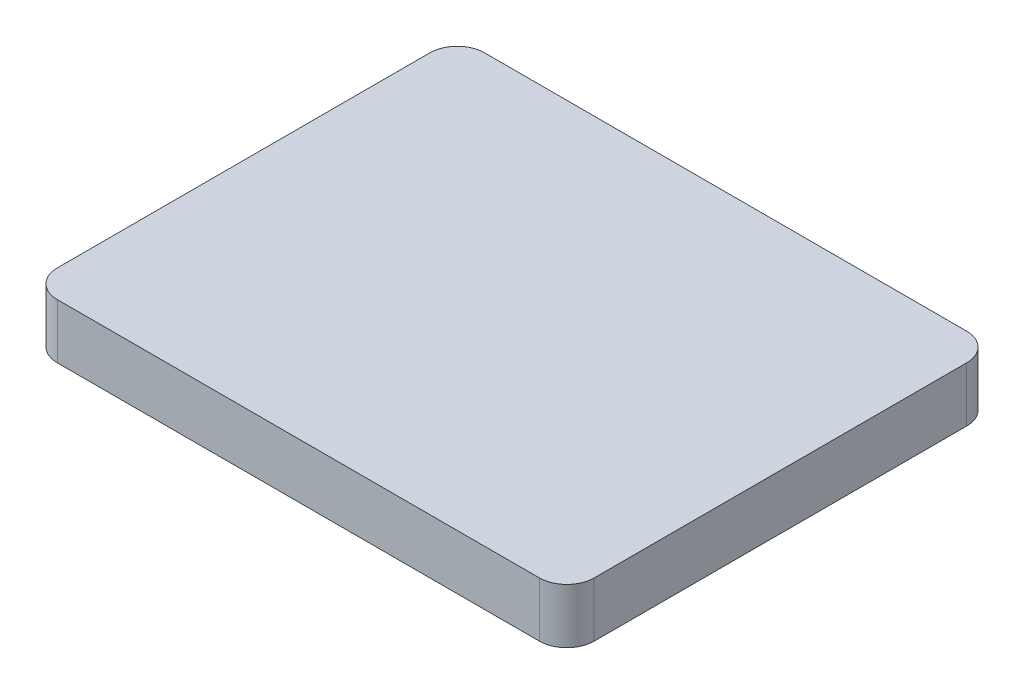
SolidWorks part; units mm, degrees
ref_plane "前视基准面" through (0, 0, 0) normal (0, 0, 1) x (1, 0, 0)
ref_plane "上视基准面" through (0, 0, 0) normal (0, 1, 0) x (1, 0, 0)
ref_plane "右视基准面" through (0, 0, 0) normal (1, 0, 0) x (0, 0, -1)
sketch "草图1" plane through (0, 0, 0) normal (0, 1, 0) x (1, 0, 0)
  line L1 (-4.9, 3.9) -> (4.9, 3.9)
  line L2 (-4.9, 3.9) -> (-4.9, -3.9)
  line L3 (-4.9, -3.9) -> (4.9, -3.9)
  line L4 (4.9, 3.9) -> (4.9, -3.9)
  line L5 (-4.9, 3.9) -> (4.9, -3.9) construction
  line L6 (-4.9, -3.9) -> (4.9, 3.9) construction
  point P0 (0, 0)
  dimension "D1" = 9.8
  dimension "D2" = 7.8
extrude "凸台-拉伸1" add sketch "草图1" along normal blind 1
fillet "圆角1" radius 0.5 4 edges at (4.9, 0.5, -3.9) (-4.9, 0.5, -3.9) (-4.9, 0.5, 3.9) (4.9, 0.5, 3.9)
